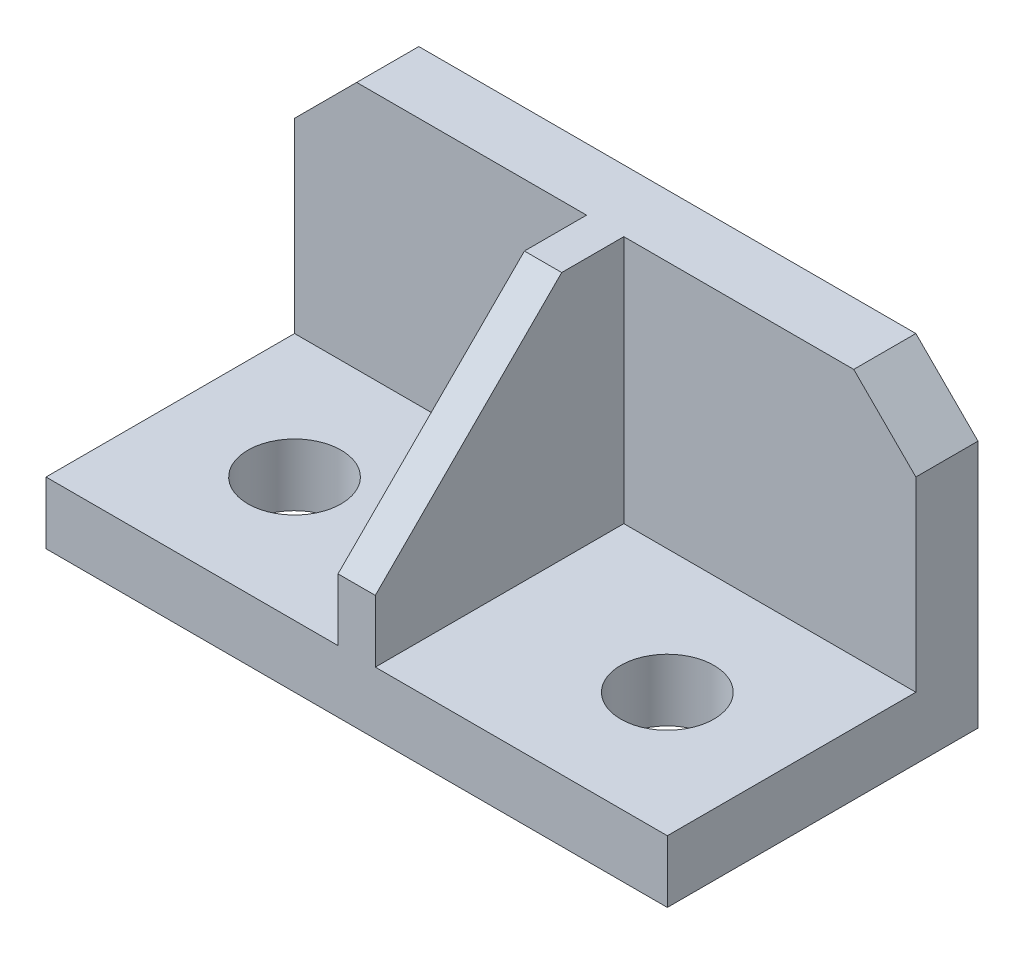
SolidWorks part; units mm, degrees
ref_plane "正面" through (0, 0, 0) normal (0, 0, 1) x (1, 0, 0)
ref_plane "平面" through (0, 0, 0) normal (0, 1, 0) x (1, 0, 0)
ref_plane "右側面" through (0, 0, 0) normal (1, 0, 0) x (0, 0, -1)
sketch "ｽｹｯﾁ1" plane through (0, 0, 0) normal (0, 1, 0) x (1, 0, 0)
  line L1 (0, 0) -> (100, 0)
  line L2 (0, 0) -> (0, 50)
  line L3 (0, 50) -> (100, 50)
  line L4 (100, 0) -> (100, 50)
  dimension "D1" = 100
  dimension "D2" = 50
extrude "押し出し1" add sketch "ｽｹｯﾁ1" along normal blind 50
shell "ｼｪﾙ1" thickness 10
sketch "ｽｹｯﾁ2" plane through (0, 10, 0) normal (0, 1, 0) x (1, 0, 0)
  line L0 (20, 20) -> (80, 20) construction
  line L1 (0, 40) -> (0, 0) construction
  line L2 (0, 0) -> (100, 0) construction
  circle A0 centre (20, 20) radius 7.5
  circle A1 centre (80, 20) radius 7.5
  dimension "D1" = 15
  dimension "D2" = 20
  dimension "D3" = 60
  dimension "D4" = 20
extrude "ｶｯﾄ - 押し出し1" cut sketch "ｽｹｯﾁ2" against normal through all
sketch "ｽｹｯﾁ3" plane through (0, 10, 0) normal (0, 1, 0) x (1, 0, 0)
  line L0 (100, 40) -> (0, 40) construction
  line L1 (47, 40) -> (53, 40)
  line L2 (47, 40) -> (47, 0)
  line L3 (47, 0) -> (53, 0)
  line L4 (53, 40) -> (53, 0)
  line L5 (0, 40) -> (0, 0) construction
  line L6 (0, 0) -> (100, 0) construction
  dimension "D1" = 47
  dimension "D2" = 6
extrude "押し出し2" add sketch "ｽｹｯﾁ3" along normal up to surface (40 mm away)
chamfer "面取り1" distance 10 angle 45 2 edges at (100, 50, -45) (0, 50, -45)
chamfer "面取り2" distance 30 angle 45 1 edges at (50, 50, 0)
